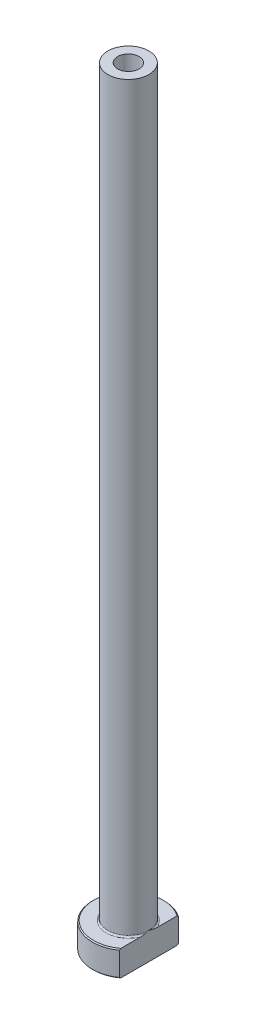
SolidWorks part; units mm, degrees
ref_plane "Front Plane" through (0, 0, 0) normal (0, 0, 1) x (1, 0, 0)
ref_plane "Top Plane" through (0, 0, 0) normal (0, 1, 0) x (1, 0, 0)
ref_plane "Right Plane" through (0, 0, 0) normal (1, 0, 0) x (0, 0, -1)
sketch "Sketch1" plane through (0, 0, 0) normal (0, 0, 1) x (1, 0, 0)
  line L0 (-2.1, 150) -> (-4, 150)
  line L1 (-4, 150) -> (-4, 5)
  line L2 (-4, 5) -> (-7, 5)
  line L3 (-7, 5) -> (-7, 0)
  line L4 (6.05, 0) -> (-6.05, 0) construction
  line L5 (-7, 0) -> (-2.35, 0)
  line L6 (-2.1, 105) -> (-2.1, 150)
  line L7 (0, 92.1877) -> (0, -15.5353) construction
  line L8 (0, -7.7) -> (0, 7.7) construction
  line L9 (-2.1, 105) -> (-2.35, 93)
  line L10 (-2.35, 93) -> (-2.35, 0)
  dimension "D1" = 0.25
  dimension "ID" = 4.2
  dimension "OD" = 8
  dimension "L" = 150
  dimension "H" = 14
  dimension "T" = 5
  dimension "N" = 45
  dimension "D2" = 12
  dimension "L-N" = 105
revolve "Revolve1" add sketch "Sketch1" angle 360 about L7
fillet "Fillet1" radius 0.3 1 edges at (0, 5, 4)
chamfer "Chamfer1" distance 0.2 angle 45 2 edges at (0, 5, 7) (0, 0, 7)
sketch "Sketch2" plane through (0, 0, 0) normal (0, -1, 0) x (1, 0, 0)
  line L0 (4, 5.7446) -> (4, -5.7446)
  circle A0 centre (0, 0) radius 7 construction
  arc A1 (4, 5.7446) -> (4, -5.7446) centre (0, 0) cw
  circle A2 centre (0, 0) radius 4 construction
extrude "Cut-Extrude1" cut sketch "Sketch2" against normal through all
chamfer "Chamfer2" distance 0.5 angle 45 1 edges at (0, 0, 2.35)
